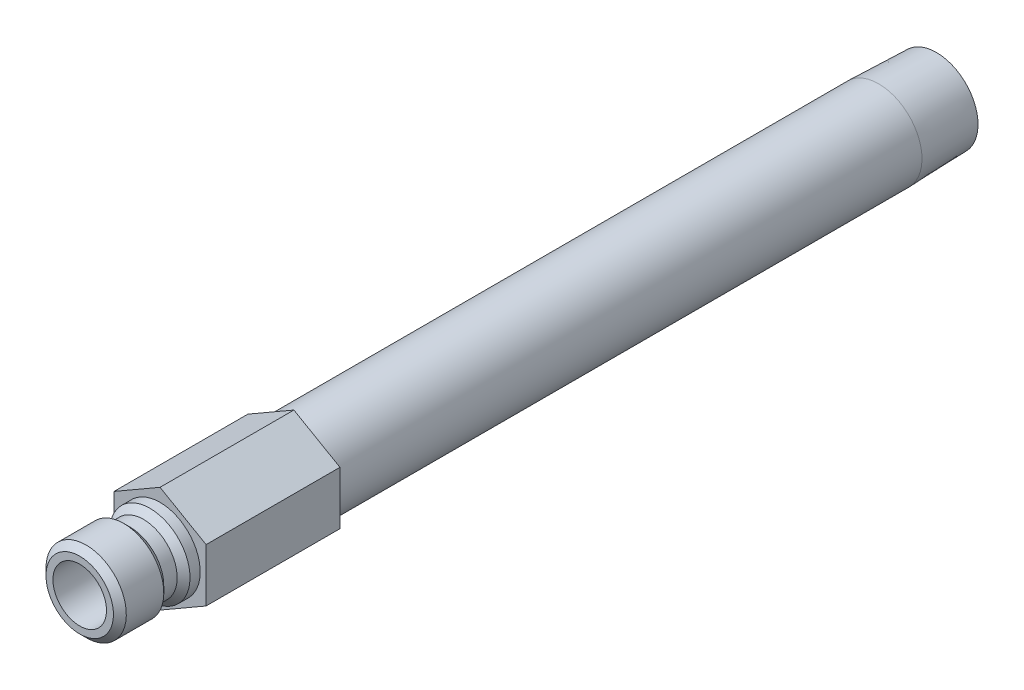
SolidWorks part; units mm, degrees
ref_plane "Front Plane" through (0, 0, 0) normal (0, 0, 1) x (1, 0, 0)
ref_plane "Top Plane" through (0, 0, 0) normal (0, 1, 0) x (1, 0, 0)
ref_plane "Right Plane" through (0, 0, 0) normal (1, 0, 0) x (0, 0, -1)
sketch "Sketch1" plane through (0, 0, 0) normal (1, 0, 0) x (0, 0, -1)
  line L0 (0, 0) -> (-12.7, 0) construction
  line L1 (-9.525, 3.175) -> (-9.525, 4.0005)
  line L2 (-3.556, 4.0005) -> (-3.556, 0) construction
  line L3 (-8.763, 4.7625) -> (-4.318, 4.7625)
  line L4 (0, 5.1435) -> (0, 3.4163) construction
  line L5 (-3.556, 4.0005) -> (-1.9685, 4.0005)
  line L6 (-1.2065, 4.7625) -> (0, 4.7625)
  line L7 (0, 4.7625) -> (0, 5.1435)
  line L8 (-3.556, 4.0005) -> (-4.318, 4.7625)
  line L9 (-1.9685, 4.0005) -> (-1.2065, 4.7625)
  line L10 (-9.525, 4.0005) -> (-8.763, 4.7625)
  line L12 (0, 5.1435) -> (85.217, 5.1435)
  line L13 (85.217, 5.1435) -> (92.075, 4.9292)
  line L14 (92.075, 4.9292) -> (92.075, 2.3813)
  line L15 (0, 0) -> (15.875, 0) construction
  line L16 (15.875, 0) -> (15.875, 4.7625) construction
  line L17 (15.875, 4.7625) -> (0, 4.7625) construction
  line L18 (0.127, 2.3813) -> (92.075, 2.3813)
  line L19 (0.127, 3.175) -> (-9.525, 3.175)
  line L20 (0, 3.175) -> (0, 0) construction
  line L21 (0.127, 2.3813) -> (0.127, 3.175)
  dimension "D1" = 9.525
  dimension "D2" = 1.5875
  dimension "D3" = 0.762
  dimension "D4" = 45
  dimension "D5" = 5.969
  dimension "D6" = 45
  dimension "D7" = 1.79
  dimension "D8" = 6.858
  dimension "D9" = 101.6
  dimension "D10" = 3.175
  dimension "D11" = 25.4
  dimension "D12" = 4.7625
  dimension "D13" = 6.35
  dimension "D14" = 9.525
  dimension "D15" = 10.287
  dimension "D16" = 9.652
revolve "Revolve1" add sketch "Sketch1" angle 360 about L0
sketch "Sketch2" plane through (0, 0, 0) normal (0, 0, 1) x (1, 0, 0)
  line L1 (-5.461, 3.1529) -> (-5.461, -3.1529)
  line L2 (-5.461, -3.1529) -> (0, -6.3058)
  line L3 (0, -6.3058) -> (5.461, -3.1529)
  line L4 (5.461, -3.1529) -> (5.461, 3.1529)
  line L5 (5.461, 3.1529) -> (0, 6.3058)
  line L6 (0, 6.3058) -> (-5.461, 3.1529)
  circle A0 centre (0, 0) radius 5.461 construction
  circle A1 centre (0, 0) radius 2.3812 construction
  circle A2 centre (0, 0) radius 2.3812
  dimension "D1" = 10.922
extrude "Boss-Extrude1" add sketch "Sketch2" against normal up to vertex (15.875 mm away) from vertex at 0
